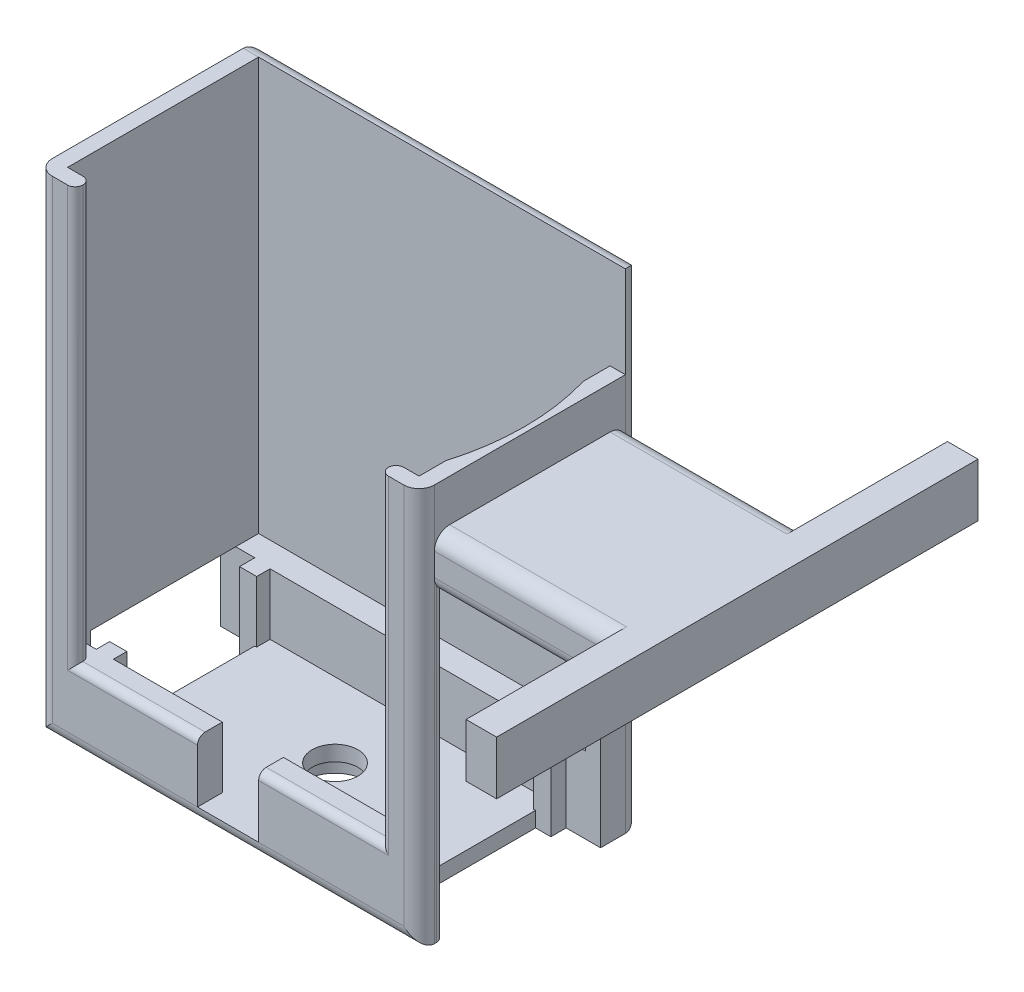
SolidWorks part; units mm, degrees
ref_plane "前视基准面" through (0, 0, 0) normal (0, 0, 1) x (1, 0, 0)
ref_plane "上视基准面" through (0, 0, 0) normal (0, 1, 0) x (1, 0, 0)
ref_plane "右视基准面" through (0, 0, 0) normal (1, 0, 0) x (0, 0, -1)
sketch "草图1" plane through (0, 0, 0) normal (0, 1, 0) x (1, 0, 0)
  line L1 (-44.2839, 1.2903) -> (5.7161, 1.2903)
  line L2 (-44.2839, 1.2903) -> (-44.2839, -0.7097)
  line L3 (-44.2839, -0.7097) -> (5.7161, -0.7097)
  line L4 (5.7161, 1.2903) -> (5.7161, -0.7097)
  dimension "D1" = 2
  dimension "D2" = 50
extrude "凸台-拉伸1" add sketch "草图1" along normal blind 64
sketch "草图2" plane through (0, 0, 0.7097) normal (0, 0, 1) x (1, 0, 0)
  line L5 (5.7161, 64) -> (5.7161, 0) construction
  line L6 (-44.2839, 0) -> (5.7161, 0)
  line L7 (-44.2839, 0) -> (-44.2839, 2)
  line L8 (-44.2839, 2) -> (5.7161, 2)
  line L9 (5.7161, 0) -> (5.7161, 2)
  dimension "D1" = 2
extrude "凸台-拉伸2" add sketch "草图2" along normal blind 27
sketch "草图5" plane through (0, 2, 0) normal (0, 1, 0) x (1, 0, 0)
  line L0 (5.7161, -27.7097) -> (5.7161, -0.7097) construction
  line L1 (-44.2839, -0.7097) -> (5.7161, -0.7097)
  line L2 (-44.2839, -0.7097) -> (-44.2839, -3.9597)
  line L3 (-44.2839, -3.9597) -> (5.7161, -3.9597)
  line L4 (5.7161, -0.7097) -> (5.7161, -3.9597)
  line L5 (-44.2839, -27.7097) -> (-44.2839, -0.7097) construction
  line L6 (5.7161, -27.7097) -> (-44.2839, -27.7097)
  line L7 (5.7161, -27.7097) -> (5.7161, -24.4597)
  line L8 (5.7161, -24.4597) -> (-44.2839, -24.4597)
  line L9 (-44.2839, -27.7097) -> (-44.2839, -24.4597)
  dimension "D1" = 3.25
  dimension "D2" = 3.25
extrude "凸台-拉伸5" add sketch "草图5" along normal blind 8 contours L8 L9 L6 L7 | L3 L4 L1 L2
sketch "草图6" plane through (0, 2, 0) normal (0, 1, 0) x (1, 0, 0)
  line L0 (5.7161, 1.2903) -> (-44.2839, 1.2903) construction
  line L1 (-44.2839, -27.7097) -> (-42.2839, -27.7097)
  line L2 (-44.2839, -27.7097) -> (-44.2839, 1.2903)
  line L3 (-44.2839, 1.2903) -> (-42.2839, 1.2903)
  line L4 (-42.2839, -27.7097) -> (-42.2839, 1.2903)
  line L5 (-44.2839, -27.7097) -> (5.7161, -27.7097) construction
  line L6 (-44.2839, 1.2903) -> (-44.2839, -27.7097) construction
  dimension "D1" = 2
  dimension "D2" = 0
  dimension "D3" = 0
  dimension "D4" = 0
extrude "凸台-拉伸6" add sketch "草图6" along normal blind 62
sketch "草图7" plane through (0, 2, 0) normal (0, 1, 0) x (1, 0, 0)
  line L0 (5.7161, -27.7097) -> (5.7161, 1.2903) construction
  line L1 (5.7161, -27.7097) -> (3.7161, -27.7097)
  line L2 (5.7161, -27.7097) -> (5.7161, 1.2903)
  line L3 (5.7161, 1.2903) -> (3.7161, 1.2903)
  line L4 (3.7161, -27.7097) -> (3.7161, 1.2903)
  line L5 (-44.2839, -27.7097) -> (5.7161, -27.7097) construction
  line L6 (5.7161, 1.2903) -> (-44.2839, 1.2903) construction
  dimension "D1" = 2
  dimension "D2" = 0
  dimension "D3" = 0
  dimension "D4" = 0
extrude "凸台-拉伸7" add sketch "草图7" along normal blind 50
sketch "草图8" plane through (0, 0, 0) normal (0, -1, 0) x (1, 0, 0)
  line L1 (-44.2839, 27.7097) -> (5.7161, 27.7097) construction
  line L2 (5.7161, 27.7097) -> (5.7161, -1.2903) construction
  circle A0 centre (-19.2839, 13.7097) radius 3
  dimension "D1" = 14
  dimension "D2" = 25
extrude "切除-拉伸1" cut sketch "草图8" against normal blind 5
sketch "草图9" plane through (0, 0, 0) normal (0, -1, 0) x (1, 0, 0)
  line L0 (-44.2839, -1.2903) -> (-44.2839, 27.7097) construction
  line L1 (-44.2839, 22.7097) -> (-37.7839, 22.7097)
  line L2 (-44.2839, 22.7097) -> (-44.2839, 3.7097)
  line L3 (-44.2839, 3.7097) -> (-37.7839, 3.7097)
  line L4 (-37.7839, 22.7097) -> (-37.7839, 3.7097)
  line L5 (-44.2839, 27.7097) -> (5.7161, 27.7097) construction
  line L6 (5.7161, -1.2903) -> (-44.2839, -1.2903) construction
  dimension "D1" = 6.5
  dimension "D2" = 5
  dimension "D3" = 5
extrude "切除-拉伸2" cut sketch "草图9" against normal blind 10
sketch "草图10" plane through (0, 0, 0) normal (0, -1, 0) x (1, 0, 0)
  line L0 (5.7161, 27.7097) -> (5.7161, -1.2903) construction
  line L1 (5.7161, 24.4597) -> (-0.7839, 24.4597)
  line L2 (5.7161, 24.4597) -> (5.7161, 3.9597)
  line L3 (5.7161, 3.9597) -> (-0.7839, 3.9597)
  line L4 (-0.7839, 24.4597) -> (-0.7839, 3.9597)
  line L5 (-37.7839, 24.4597) -> (-44.2839, 24.4597) construction
  line L6 (-44.2839, 3.9597) -> (-37.7839, 3.9597) construction
  dimension "D1" = 6.5
  dimension "D2" = 0
  dimension "D3" = 0
extrude "切除-拉伸3" cut sketch "草图10" against normal blind 39.5
sketch "草图11" plane through (-42.2839, 0, 0) normal (1, 0, 0) x (0, 0, -1)
  line L1 (-27.7097, 64) -> (-25.7097, 64)
  line L2 (-27.7097, 64) -> (-27.7097, 10)
  line L3 (-27.7097, 10) -> (-25.7097, 10)
  line L4 (-25.7097, 64) -> (-25.7097, 10)
  dimension "D1" = 2
extrude "凸台-拉伸8" add sketch "草图11" along normal blind 3
sketch "草图12" plane through (3.7161, 0, 0) normal (-1, 0, 0) x (0, 0, 1)
  line L1 (27.7097, 52) -> (25.7097, 52)
  line L2 (27.7097, 52) -> (27.7097, 10)
  line L3 (27.7097, 10) -> (25.7097, 10)
  line L4 (25.7097, 52) -> (25.7097, 10)
  dimension "D1" = 2
extrude "凸台-拉伸9" add sketch "草图12" along normal blind 3
fillet "圆角1" radius 2 7 edges at (-19.2839, 0, -1.2903) (-19.2839, 64, -1.2903) (5.7161, 32, -1.2903) (5.7161, 26, 27.7097) (-19.2839, 0, 27.7097) (-44.2839, 32, -1.2903) (-44.2839, 32, 27.7097)
fillet "圆角2" radius 1 6 edges at (-39.2839, 37, 27.7097) (0.7161, 31, 27.7097) (5.7161, 19.75, 24.4597) (-19.2839, 10, 27.7097) (0.7161, 31, 25.7097) (-39.2839, 37, 25.7097)
sketch "草图13" plane through (0, 0, 27.7097) normal (0, 0, 1) x (1, 0, 0)
  line L0 (-42.2839, 2) -> (3.7161, 2) construction
  line L1 (-23.2839, 2) -> (-15.2839, 2)
  line L2 (-23.2839, 2) -> (-23.2839, 10)
  line L3 (-23.2839, 10) -> (-15.2839, 10)
  line L4 (-15.2839, 2) -> (-15.2839, 10)
  line L5 (-42.2839, 10) -> (3.7161, 10) construction
  line L6 (5.7161, 52) -> (5.7161, 0) construction
  dimension "D1" = 8
  dimension "D2" = 21
extrude "切除-拉伸4" cut sketch "草图13" against normal blind 5
sketch "草图14" plane through (5.7161, 0, 0) normal (1, 0, 0) x (0, 0, -1)
  line L0 (-25.7097, 52) -> (-25.7097, 0) construction
  line L1 (-25.7097, 39.5) -> (-0.7097, 39.5)
  line L2 (-25.7097, 39.5) -> (-25.7097, 46.5)
  line L3 (-25.7097, 46.5) -> (-0.7097, 46.5)
  line L4 (-0.7097, 39.5) -> (-0.7097, 46.5)
  line L5 (-0.7097, 0) -> (-0.7097, 52) construction
  line L6 (-3.9597, 0) -> (-0.7097, 0) construction
  dimension "D1" = 39.5
  dimension "D2" = 7
extrude "凸台-拉伸10" add sketch "草图14" along normal blind 23.15
sketch "草图15" plane through (28.8661, 0, 0) normal (1, 0, 0) x (0, 0, -1)
  line L1 (-0.7097, 46.5) -> (-25.7097, 46.5) construction
  line L2 (-44.7097, 39.5) -> (18.2903, 39.5)
  line L3 (-44.7097, 39.5) -> (-44.7097, 46.5)
  line L4 (-44.7097, 46.5) -> (18.2903, 46.5)
  line L5 (18.2903, 39.5) -> (18.2903, 46.5)
  line L6 (-25.7097, 39.5) -> (-0.7097, 39.5) construction
  line L7 (-0.7097, 39.5) -> (-0.7097, 46.5) construction
  line L8 (-25.7097, 46.5) -> (-25.7097, 39.5) construction
  dimension "D1" = 0
  dimension "D2" = 0
  dimension "D3" = 19
  dimension "D4" = 19
extrude "凸台-拉伸11" add sketch "草图15" along normal blind 4
fillet "圆角3" radius 2 4 edges at (17.2911, 39.5, 25.7097) (17.2911, 46.5, 25.7097) (17.2911, 46.5, 0.7097) (17.2911, 39.5, 0.7097)
sketch "草图16" plane through (0, 0, 0) normal (0, -1, 0) x (1, 0, 0)
  circle A0 centre (-19.2839, 13.7097) radius 4
  circle A1 centre (-19.2839, 13.7097) radius 6
  dimension "D1" = 8
extrude "凸台-拉伸12" add sketch "草图16" along normal blind 2
sketch "草图17" plane through (0, 52, 0) normal (0, 1, 0) x (1, 0, 0)
  line L0 (3.7161, -0.7097) -> (3.7161, -25.7097) construction
  line L1 (5.7161, -25.7097) -> (5.7161, -0.7097) construction
  line L2 (-42.2839, -0.7097) -> (5.7161, -0.7097) construction
  line L3 (3.7161, -22.2097) -> (3.7161, -4.2097)
  arc A0 (3.7161, -4.2097) -> (3.7161, -22.2097) centre (-26.7877, -13.2097) cw
  point P3 (5.0161, -13.2097)
  dimension "D1" = 0.7
  dimension "D2" = 18
  dimension "D3" = 3.5
extrude "切除-拉伸5" cut sketch "草图17" against normal blind 22
sketch "草图19" plane through (-37.7839, 0, 0) normal (-1, 0, 0) x (0, 0, 1)
  line L0 (3.9597, 2) -> (22.7097, 2) construction
  line L1 (3.7097, 0) -> (5.7097, 0)
  line L2 (3.7097, 0) -> (3.7097, 2)
  line L3 (3.7097, 2) -> (5.7097, 2)
  line L4 (5.7097, 0) -> (5.7097, 2)
  line L13 (3.7097, 10) -> (3.7097, 0) construction
  dimension "D1" = 0
extrude "凸台-拉伸13" add sketch "草图19" along normal blind 2
sketch "草图20" plane through (-0.7839, 0, 0) normal (1, 0, 0) x (0, 0, -1)
  line L0 (-24.4597, 0) -> (-3.9597, 0) construction
  line L1 (-24.4597, 2) -> (-22.4597, 2)
  line L2 (-24.4597, 2) -> (-24.4597, 0)
  line L3 (-24.4597, 0) -> (-22.4597, 0)
  line L4 (-22.4597, 2) -> (-22.4597, 0)
  line L5 (-24.4597, 2) -> (-3.9597, 2) construction
  line L6 (-3.9597, 0) -> (-5.9597, 0)
  line L7 (-3.9597, 0) -> (-3.9597, 2)
  line L8 (-3.9597, 2) -> (-5.9597, 2)
  line L9 (-5.9597, 0) -> (-5.9597, 2)
  dimension "D1" = 2
  dimension "D2" = 2
extrude "凸台-拉伸14" add sketch "草图20" along normal blind 2
sketch "草图21" plane through (0, 2, 0) normal (0, 1, 0) x (1, 0, 0)
  line L0 (-23.2839, -24.4597) -> (-42.2839, -24.4597) construction
  line L1 (-39.7839, -3.7097) -> (-37.5339, -3.7097)
  line L2 (-39.7839, -3.7097) -> (-39.7839, -5.7097)
  line L3 (-39.7839, -5.7097) -> (-37.5339, -5.7097)
  line L4 (-37.5339, -3.7097) -> (-37.5339, -5.7097)
  line L5 (-39.7839, -22.7097) -> (-37.5339, -22.7097)
  line L6 (-39.7839, -22.7097) -> (-39.7839, -24.4597)
  line L7 (-39.7839, -24.4597) -> (-37.5339, -24.4597)
  line L8 (-37.5339, -22.7097) -> (-37.5339, -24.4597)
  line L9 (-37.7839, -22.7097) -> (-42.2839, -22.7097) construction
  line L10 (1.2161, -3.9597) -> (-1.0339, -3.9597)
  line L11 (1.2161, -3.9597) -> (1.2161, -5.9597)
  line L12 (1.2161, -5.9597) -> (-1.0339, -5.9597)
  line L13 (-1.0339, -3.9597) -> (-1.0339, -5.9597)
  line L14 (1.2161, -22.4597) -> (-1.0339, -22.4597)
  line L15 (1.2161, -22.4597) -> (1.2161, -24.4597)
  line L16 (1.2161, -24.4597) -> (-1.0339, -24.4597)
  line L17 (-1.0339, -22.4597) -> (-1.0339, -24.4597)
  line L19 (-37.7839, -5.7097) -> (-37.7839, -22.7097) construction
  line L20 (-39.7839, -5.7097) -> (-37.7839, -5.7097) construction
  line L21 (-42.2839, -3.7097) -> (-37.7839, -3.7097) construction
  line L23 (-39.7839, -5.7097) -> (-39.7839, -3.7097) construction
  line L24 (1.2161, -5.9597) -> (-0.7839, -5.9597) construction
  line L27 (1.2161, -3.9597) -> (1.2161, -5.9597) construction
  line L28 (-0.7839, -22.4597) -> (-0.7839, -5.9597) construction
  line L29 (1.2161, -24.4597) -> (-15.2839, -24.4597) construction
  dimension "D1" = 0
  dimension "D2" = 0.25
  dimension "D3" = 0
  dimension "D4" = 0
  dimension "D5" = 0
  dimension "D6" = 0
  dimension "D7" = 0.25
  dimension "D8" = 0
  dimension "D9" = 0.25
  dimension "D10" = 0
extrude "凸台-拉伸15" add sketch "草图21" along normal blind 8
sketch "草图22" plane through (0, 0, 0) normal (0, -1, 0) x (1, 0, 0)
  line L0 (5.7161, 25.7097) -> (-44.2839, 25.7097) construction
  line L1 (-37.7519, 25.7097) -> (-0.863, 25.7097)
  line L2 (-37.7519, 25.7097) -> (-37.7519, 0.7097)
  line L3 (-37.7519, 0.7097) -> (-0.863, 0.7097)
  line L4 (-0.863, 25.7097) -> (-0.863, 0.7097)
  line L5 (-44.2839, 0.7097) -> (5.7161, 0.7097) construction
